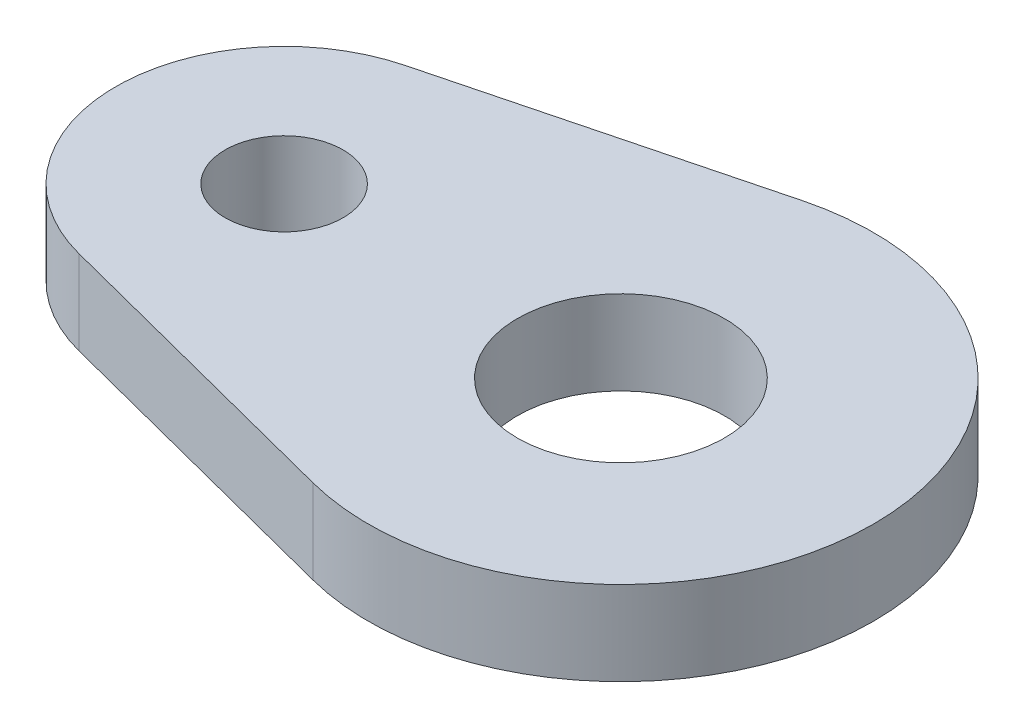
SolidWorks part; units mm, degrees
ref_plane "Plan de face" through (0, 0, 0) normal (0, 0, 1) x (1, 0, 0)
ref_plane "Plan de dessus" through (0, 0, 0) normal (0, 1, 0) x (1, 0, 0)
ref_plane "Plan de droite" through (0, 0, 0) normal (1, 0, 0) x (0, 0, -1)
ref_plane "Plan1" through (0, -5, 0) normal (0, -1, 0) x (1, 0, 0)
sketch "Esquisse1" plane through (0, -5, 0) normal (0, -1, 0) x (1, 0, 0)
  line L0 (-22.5, -9.6825) -> (-3.75, -14.5237)
  line L1 (-3.75, 14.5237) -> (-22.5, 9.6825)
  circle A0 centre (0, 0) radius 6.15
  circle A1 centre (-20, 0) radius 3.5
  arc A2 (-3.75, -14.5237) -> (-3.75, 14.5237) centre (0, 0) ccw
  arc A3 (-22.5, 9.6825) -> (-22.5, -9.6825) centre (-20, 0) ccw
extrude "Boss.-Extru.1" add sketch "Esquisse1" against normal blind 5
